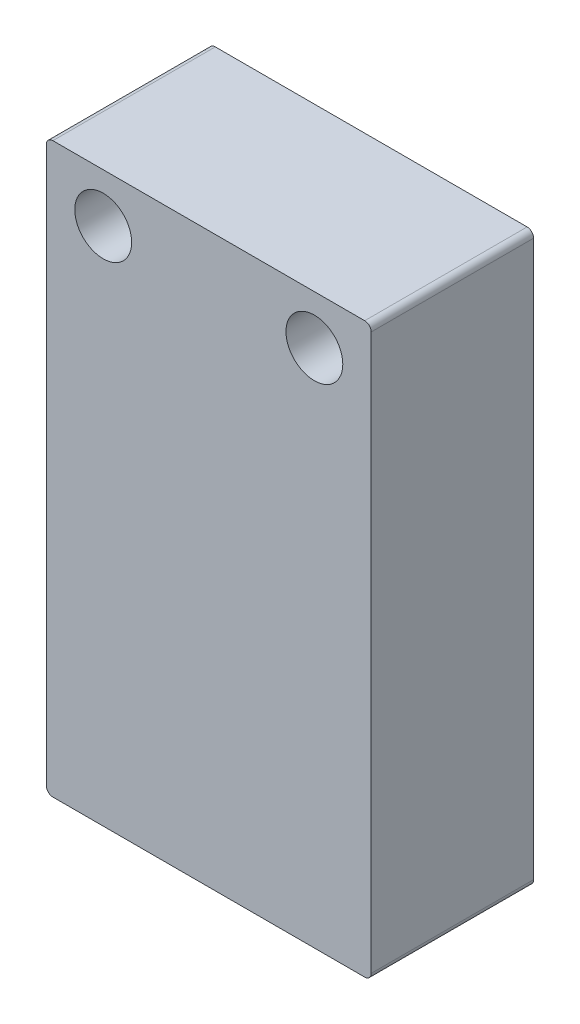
SolidWorks part; units mm, degrees
ref_plane "Plan de face" through (0, 0, 0) normal (0, 0, 1) x (1, 0, 0)
ref_plane "Plan de dessus" through (0, 0, 0) normal (0, 1, 0) x (1, 0, 0)
ref_plane "Plan de droite" through (0, 0, 0) normal (1, 0, 0) x (0, 0, -1)
sketch "Esquisse1" plane through (0, 0, 0) normal (0, 0, 1) x (1, 0, 0)
  line L1 (0.8, 0) -> (39.2, 0)
  line L2 (0, 0.8) -> (0, 69.2)
  line L3 (0.8, 70) -> (39.2, 70)
  line L4 (40, 0.8) -> (40, 69.2)
  circle A0 centre (7, 64) radius 3.5
  circle A1 centre (33, 64) radius 3.5
  arc A2 (0, 69.2) -> (0.8, 70) centre (0.8, 69.2) cw
  arc A3 (39.2, 70) -> (40, 69.2) centre (39.2, 69.2) cw
  arc A4 (39.2, 0) -> (40, 0.8) centre (39.2, 0.8) ccw
  arc A5 (0.8, 0) -> (0, 0.8) centre (0.8, 0.8) cw
  point P17 (0, 0)
  dimension "D5" = 7
  dimension "D6" = 7
  dimension "D7" = 7
  dimension "D8" = 0.8
  dimension "D1" = 40
  dimension "D2" = 70
  dimension "D3" = 7
  dimension "D4" = 6
extrude "Extrusion1" add sketch "Esquisse1" against normal blind 20
